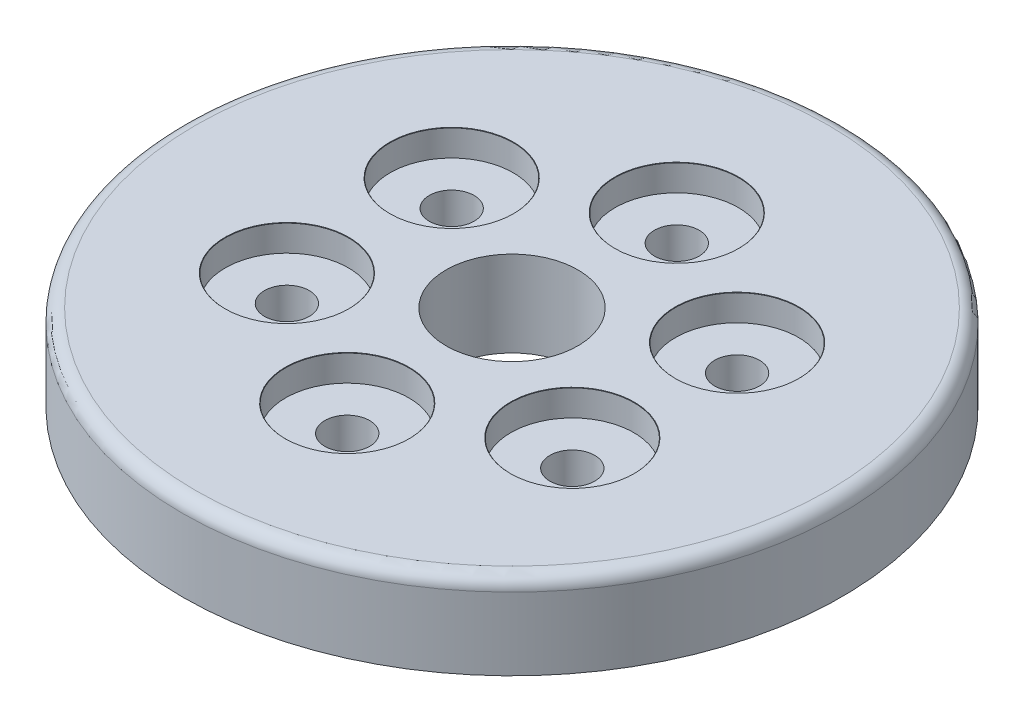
SolidWorks part; units mm, degrees
ref_plane "Front Plane" through (0, 0, 0) normal (0, 0, 1) x (1, 0, 0)
ref_plane "Top Plane" through (0, 0, 0) normal (0, 1, 0) x (1, 0, 0)
ref_plane "Right Plane" through (0, 0, 0) normal (1, 0, 0) x (0, 0, -1)
sketch "Sketch1" plane through (0, 0, 0) normal (0, 1, 0) x (1, 0, 0)
  circle A0 centre (0, 0) radius 25
extrude "Boss-Extrude1" add sketch "Sketch1" along normal blind 6.5
sketch "Sketch2" plane through (0, 6.5, 0) normal (0, 1, 0) x (1, 0, 0)
  circle A0 centre (0, 0) radius 12.5
  circle A1 centre (0, 12.5) radius 1.2
  circle A2 centre (10.8253, 6.25) radius 1.2
  circle A3 centre (10.8253, -6.25) radius 1.2
  circle A4 centre (0, -12.5) radius 1.2
  circle A5 centre (-10.8253, -6.25) radius 1.2
  circle A6 centre (-10.8253, 6.25) radius 1.2
  point P3 (0, 12.5)
  point P7 (10.8253, 6.25)
  point P9 (10.8253, -6.25)
  point P11 (0, -12.5)
  point P13 (-10.8253, -6.25)
  point P15 (-10.8253, 6.25)
  point P17 (0, 0)
  dimension "D1" = 6
hole_wizard "CBORE for M3 Hex Head Cap Screw1" positions "Sketch2" profile "Sketch4" counterbore size "M3" standard "ISO"
sketch "Sketch4" plane through (-10.8253, 6.5, -6.25) normal (1, 0, 0) x (0, 0, 1)
  line L0 (0, 0) -> (0, 6.5)
  line L1 (0, 6.5) -> (1.7, 6.5)
  line L3 (1.7, 6.5) -> (1.7, 2)
  line L4 (4.6755, 2) -> (1.7, 2)
  line L5 (4.6755, 2) -> (4.6755, 0.025)
  line L6 (4.6755, 0.025) -> (4.7005, 0)
  line L7 (4.7005, 0) -> (0, 0)
  line L8 (-4.6755, 0.025) -> (-4.7005, 0) construction
  line L11 (0, -6.35) -> (0, 107.95) construction
  dimension "Thru Hole Dia." = 3.4
  dimension "Thru Hole Depth" = 6.5
  dimension "C'Bore Dia." = 9.351
  dimension "C'Bore Depth" = 2
  dimension "Near C'Sink Dia." = 9.401
  dimension "Near C'Sink Angle" = 90
fillet "Fillet1" radius 1 1 edges at (0, 6.5, 25)
sketch "Sketch5" plane through (0, 6.5, 0) normal (0, 1, 0) x (1, 0, 0)
  circle A0 centre (0, 0) radius 5
extrude "Cut-Extrude1" cut sketch "Sketch5" against normal blind 20.7
